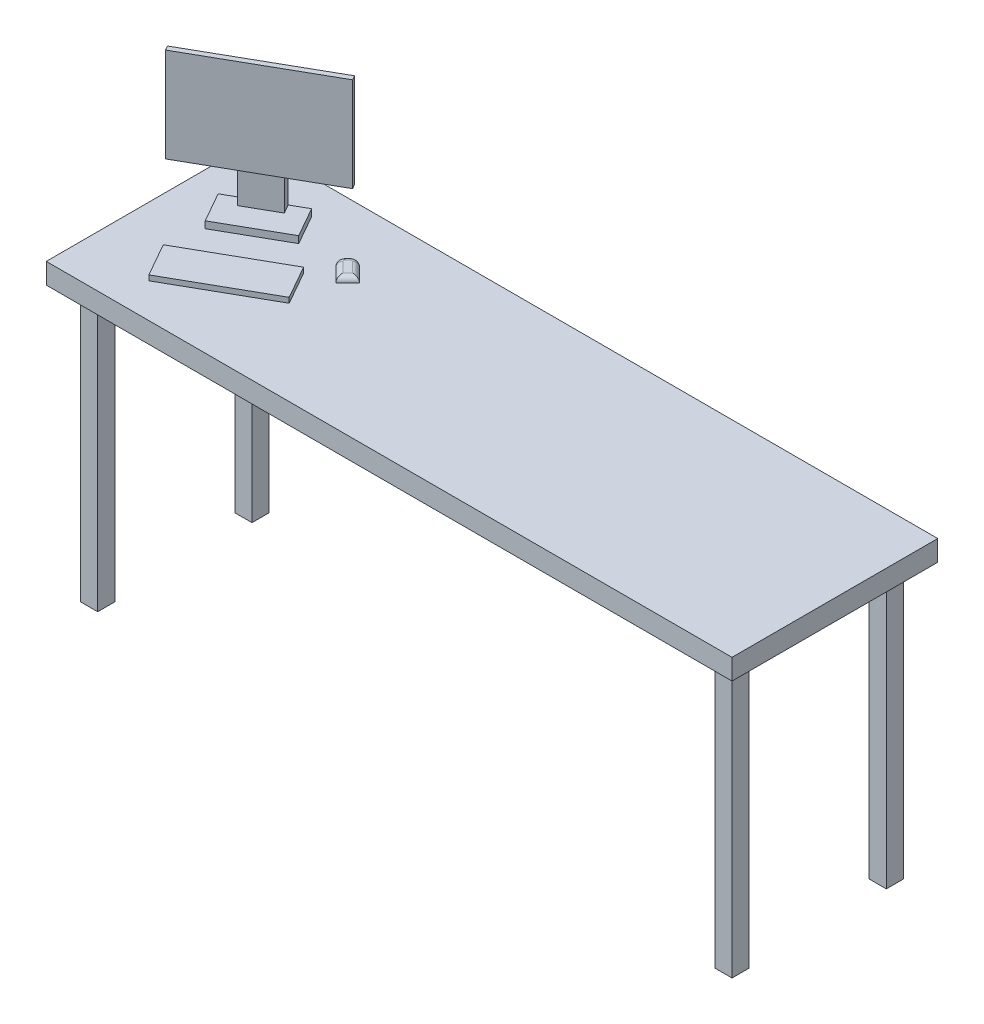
SolidWorks part; units mm, degrees
ref_plane "Plan de face" through (0, 0, 0) normal (0, 0, 1) x (1, 0, 0)
ref_plane "Plan de dessus" through (0, 0, 0) normal (0, 1, 0) x (1, 0, 0)
ref_plane "Plan de droite" through (0, 0, 0) normal (1, 0, 0) x (0, 0, -1)
sketch "Esquisse1" plane through (0, 0, 0) normal (0, 1, 0) x (1, 0, 0)
  line L1 (1000, -300) -> (-1000, -300)
  line L2 (1000, -300) -> (1000, 300)
  line L3 (1000, 300) -> (-1000, 300)
  line L4 (-1000, -300) -> (-1000, 300)
  line L5 (1000, -300) -> (-1000, 300) construction
  line L6 (1000, 300) -> (-1000, -300) construction
  point P0 (0, 0)
  dimension "D1" = 600
  dimension "D2" = 2000
extrude "Boss.-Extru.1" add sketch "Esquisse1" along normal blind 60
sketch "Esquisse2" plane through (0, 0, 0) normal (0, -1, 0) x (1, 0, 0)
  line L0 (-1000, 300) -> (1000, 300) construction
  line L1 (-950, 250) -> (-900, 250)
  line L2 (-950, 250) -> (-950, 200)
  line L3 (-950, 200) -> (-900, 200)
  line L4 (-900, 250) -> (-900, 200)
  line L5 (-950, 250) -> (-900, 200) construction
  line L6 (-950, 200) -> (-900, 250) construction
  line L7 (-1000, -300) -> (-1000, 300) construction
  point P0 (-925, 225)
  dimension "D1" = 50
  dimension "D2" = 50
  dimension "D3" = 50
  dimension "D4" = 50
extrude "Boss.-Extru.2" add sketch "Esquisse2" along normal blind 800
mirror "Symétrie1" about plane through (0, 0, 0) normal (1, 0, 0) of "Boss.-Extru.2"
mirror "Symétrie2" about plane through (0, 0, 0) normal (0, 0, 1) of "Symétrie1", "Boss.-Extru.2"
sketch "Esquisse3" plane through (0, 60, 0) normal (0, 1, 0) x (1, 0, 0)
  line L0 (-850.6278, 14.2936) -> (-900, 101.2556)
  line L1 (-850.6278, 14.2936) -> (-676.7038, 113.038)
  line L2 (-900, 101.2556) -> (-726.076, 200)
  line L3 (-676.7038, 113.038) -> (-726.076, 200)
  line L4 (1000, 300) -> (-1000, 300) construction
  line L5 (-1000, 300) -> (-1000, -300) construction
  dimension "D1" = 200
  dimension "D2" = 100
  dimension "D3" = 100
  dimension "D4" = 100
extrude "Boss.-Extru.3" add sketch "Esquisse3" along normal blind 20
sketch "Esquisse4" plane through (0, 80, 0) normal (0, 1, 0) x (1, 0, 0)
  line L0 (-856.519, 125.9417) -> (-769.557, 175.3139)
  line L1 (-856.519, 125.9417) -> (-841.7074, 99.8531)
  line L2 (-769.557, 175.3139) -> (-754.7454, 149.2253)
  line L3 (-841.7074, 99.8531) -> (-754.7454, 149.2253)
  line L4 (-726.076, 200) -> (-900, 101.2556) construction
  line L5 (-900, 101.2556) -> (-850.6278, 14.2936) construction
  line L6 (-676.7038, 113.038) -> (-726.076, 200) construction
  dimension "D1" = 50
  dimension "D2" = 50
  dimension "D3" = 30
extrude "Boss.-Extru.4" add sketch "Esquisse4" along normal blind 200
sketch "Esquisse5" plane through (-248.0477, 0, -436.9002) normal (0.4937, 0, 0.8696) x (0.8696, 0, -0.4937)
  line L0 (-582.6657, 280) -> (-682.6657, 280) construction
  line L1 (-832.6657, 180) -> (-432.6657, 180)
  line L2 (-832.6657, 180) -> (-832.6657, 455)
  line L3 (-832.6657, 455) -> (-432.6657, 455)
  line L4 (-432.6657, 180) -> (-432.6657, 455)
  line L5 (-732.6657, 80) -> (-532.6657, 80) construction
  point P4 (-632.6657, 280)
  dimension "D1" = 400
  dimension "D2" = 200
  dimension "D3" = 275
  dimension "D4" = 100
extrude "Boss.-Extru.5" add sketch "Esquisse5" along normal blind 15
sketch "Esquisse6" plane through (0, 60, 0) normal (0, 1, 0) x (1, 0, 0)
  line L0 (-856.3031, -102.3156) -> (-595.0047, 45.6485)
  line L1 (-856.3031, -102.3156) -> (-801.2841, -199.4768)
  line L2 (-595.0047, 45.6485) -> (-539.9857, -51.5127)
  line L3 (-801.2841, -199.4768) -> (-539.9857, -51.5127)
extrude "Boss.-Extru.6" add sketch "Esquisse6" along normal blind 15
sketch "Esquisse7" plane through (0, 60, 0) normal (0, 1, 0) x (1, 0, 0)
  line L0 (-577.028, 121.3966) -> (-542.3432, 156.0813)
  line L1 (-577.028, 121.3966) -> (-523.4243, 67.7929)
  line L2 (-542.3432, 156.0813) -> (-488.7395, 102.4776)
  line L3 (-523.4243, 67.7929) -> (-488.7395, 102.4776)
extrude "Boss.-Extru.7" add sketch "Esquisse7" along normal blind 15
fillet "Congé1" radius 20 2 edges at (-542.3432, 67.5, -156.0813) (-577.028, 67.5, -121.3966)
fillet "Congé2" radius 15 6 edges at (-506.0819, 75, -85.1353) (-543.1551, 75, -87.5237) (-568.7437, 75, -121.3966) (-559.6856, 75, -138.739) (-542.3432, 75, -147.7971) (-508.4703, 75, -122.2084)
